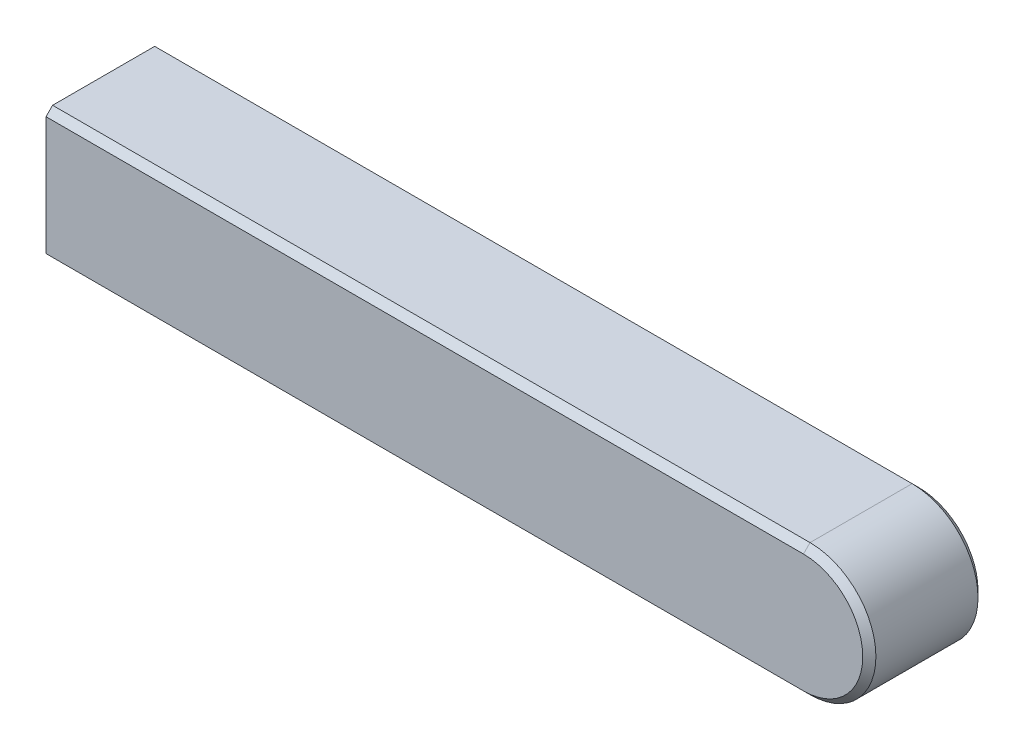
SolidWorks part; units mm, degrees
ref_plane "Front" through (0, 0, 0) normal (0, 0, 1) x (1, 0, 0)
ref_plane "Top" through (0, 0, 0) normal (0, 1, 0) x (1, 0, 0)
ref_plane "Right" through (0, 0, 0) normal (1, 0, 0) x (0, 0, -1)
other "Configuration Table"
sketch "body" plane through (0, 0, 0) normal (0, 0, 1) x (1, 0, 0)
  line L1 (0, 0) -> (46, 0)
  line L2 (0, 0) -> (0, 8)
  line L3 (0, 8) -> (46, 8)
  arc A0 (46, 8) -> (46, 0) centre (46, 4) cw
  dimension "Width" = 8
  dimension "Length" = 50
extrude "Extrude1" add sketch "body" along normal blind 7
chamfer "Chamfer1" distance 0.4 6 edges at (23, 0, 0) (50, 4, 0) (23, 8, 0) (23, 0, 7) (50, 4, 7) (23, 8, 7)
